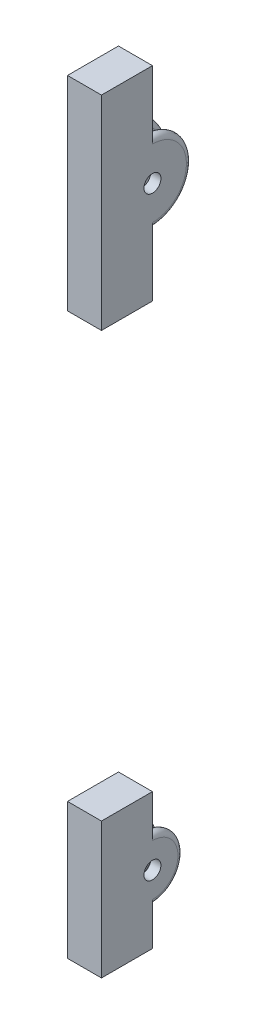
SolidWorks part; units mm, degrees
ref_plane "Front Plane" through (0, 0, 0) normal (0, 0, 1) x (1, 0, 0)
ref_plane "Top Plane" through (0, 0, 0) normal (0, 1, 0) x (1, 0, 0)
ref_plane "Right Plane" through (0, 0, 0) normal (1, 0, 0) x (0, 0, -1)
sketch "Sketch1" plane through (0, 0, 0) normal (0, 0, 1) x (1, 0, 0)
  line L1 (-10, 60) -> (10, 60)
  line L2 (-10, 60) -> (-10, -60)
  line L3 (-10, -60) -> (10, -60)
  line L4 (10, 60) -> (10, -60)
  line L5 (-10, -310) -> (10, -310)
  line L6 (-10, -310) -> (-10, -390)
  line L7 (-10, -390) -> (10, -390)
  line L8 (10, -310) -> (10, -390)
  point P4 (0, -60)
  point P5 (0, 60)
  point P6 (-10, 0)
  point P8 (10, 0)
  dimension "D1" = 20
  dimension "D2" = 120
  dimension "D3" = 250
  dimension "D4" = 80
extrude "Boss-Extrude1" add sketch "Sketch1" along normal blind 30
sketch "Sketch2" plane through (0, 0, 0) normal (0, 0, -1) x (-1, 0, 0)
  line L0 (-10, -60) -> (-10, 60) construction
  line L1 (-10, 0) -> (-4, 0)
  line L2 (-10, 0) -> (-10, 20)
  line L3 (-10, 20) -> (-4, 20) construction
  line L4 (-4, 0) -> (-4, 20)
  line L5 (0, 0) -> (0, 60) construction
  line L6 (-10, 60) -> (10, 60) construction
  line L7 (10, 20) -> (4, 20) construction
  line L8 (4, 0) -> (4, 20)
  line L9 (10, 0) -> (10, 20)
  line L10 (10, 0) -> (4, 0)
  arc A0 (-4, 20) -> (-10, 20) centre (-7, 20) ccw
  arc A1 (4, 20) -> (10, 20) centre (7, 20) cw
  point P10 (0, 60)
  dimension "D1" = 20
  dimension "D2" = 6
revolve "Revolve1" add sketch "Sketch2" angle 180 about L1
sketch "Sketch3" plane through (10, 0, 0) normal (1, 0, 0) x (0, 0, -1)
  circle A0 centre (0, 0) radius 5
  dimension "D1" = 10
extrude "Cut-Extrude1" cut sketch "Sketch3" against normal through all
sketch "Sketch4" plane through (0, 0, 0) normal (0, 0, -1) x (-1, 0, 0)
  line L0 (4, 5) -> (4, 20) construction
  line L1 (-4, 5) -> (4, 5) construction
  line L2 (-4, 20) -> (-4, 5) construction
  line L3 (4, 5) -> (4, 20)
  line L4 (-4, 5) -> (4, 5)
  line L5 (-4, 20) -> (-4, 5)
  line L6 (-4, 20) -> (4, 20)
  line L7 (-34.6789, 0) -> (-23.4943, 0) construction
revolve "Cut-Revolve1" cut sketch "Sketch4" angle 360 about L7
sketch "Sketch5" plane through (0, 0, 0) normal (0, 0, -1) x (-1, 0, 0)
  line L0 (-10, -390) -> (-10, -310) construction
  line L1 (-10, -350) -> (-4, -350)
  line L2 (-10, -350) -> (-10, -335)
  line L3 (-10, -335) -> (-4, -335) construction
  line L4 (-4, -350) -> (-4, -335)
  line L5 (-4, -20) -> (-4, 20) construction
  line L6 (0, -350) -> (0, -339.0937) construction
  line L7 (-10, -310) -> (10, -310) construction
  line L8 (10, -335) -> (4, -335) construction
  line L9 (4, -350) -> (4, -335)
  line L10 (10, -350) -> (10, -335)
  line L11 (10, -350) -> (4, -350)
  arc A0 (-4, -335) -> (-10, -335) centre (-7, -335) ccw
  arc A1 (4, -335) -> (10, -335) centre (7, -335) cw
  point P8 (-7, -335)
  point P11 (-10, -350)
  point P15 (0, -310)
  dimension "D1" = 15
revolve "Revolve2" add sketch "Sketch5" angle 360 about L1
sketch "Sketch6" plane through (0, 0, 0) normal (0, 0, -1) x (-1, 0, 0)
  line L0 (-4, -365) -> (-4, -335) construction
  line L1 (-4, -335) -> (4, -335)
  line L2 (-4, -335) -> (-4, -350)
  line L3 (-4, -350) -> (4, -350)
  line L4 (4, -335) -> (4, -350)
  line L5 (4, -335) -> (4, -365) construction
  point P11 (4, -350)
revolve "Cut-Revolve2" cut sketch "Sketch6" angle 360 about L3
sketch "Sketch7" plane through (-4, 0, 0) normal (1, 0, 0) x (0, 0, -1)
  circle A0 centre (0, -350) radius 5
  arc A1 (0, -365) -> (0, -335) centre (0, -350) ccw construction
  dimension "D1" = 10
extrude "Cut-Extrude2" cut sketch "Sketch7" against normal through all both and the other way through all
